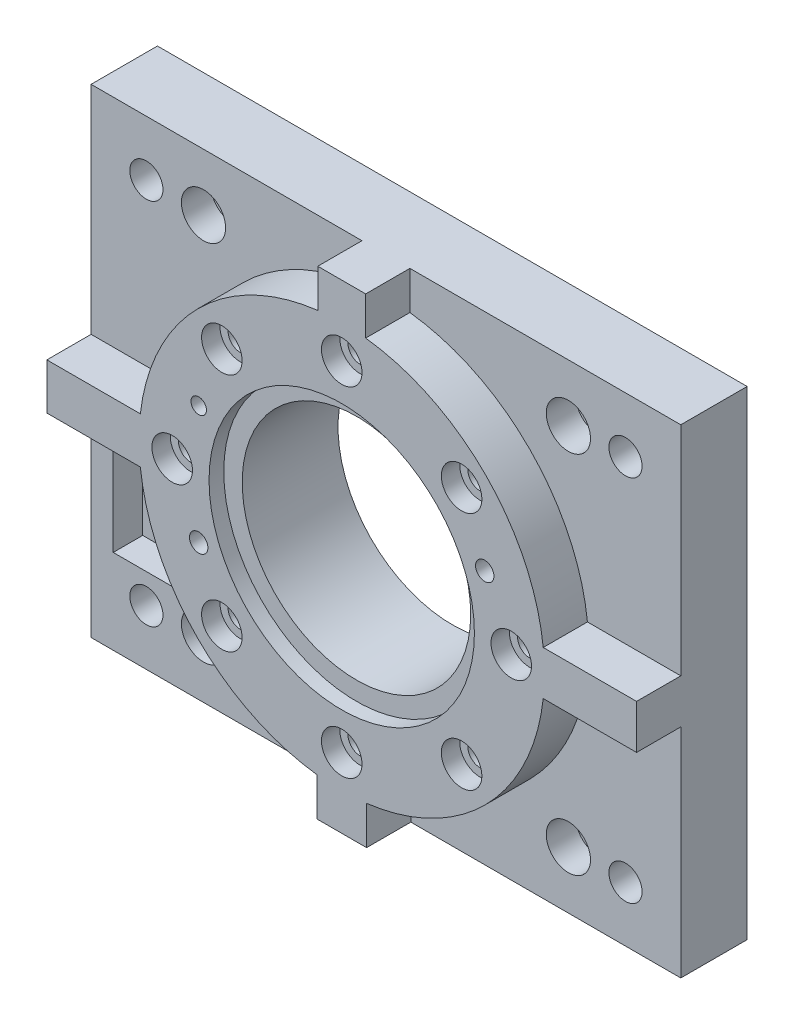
SolidWorks part; units mm, degrees
ref_plane "前视基准面" through (0, 0, 0) normal (0, 0, 1) x (1, 0, 0)
ref_plane "上视基准面" through (0, 0, 0) normal (0, 1, 0) x (1, 0, 0)
ref_plane "右视基准面" through (0, 0, 0) normal (1, 0, 0) x (0, 0, -1)
other "Configuration Table"
sketch "AICAD_SKETCH_F_BASE" plane through (0, 0, 0) normal (0, 0, 1) x (1, 0, 0)
  line L0 (-80, -65) -> (80, -65)
  line L1 (80, -65) -> (80, 65)
  line L2 (80, 65) -> (-80, 65)
  line L3 (-80, 65) -> (-80, -65)
  point P0 (0, 0)
  dimension "D1" = 80
  dimension "D2" = 160
  dimension "D3" = 65
  dimension "D4" = 130
extrude "AICAD_F_BASE_BASE_EXTRUDE" add sketch "AICAD_SKETCH_F_BASE" along normal blind 18
sketch "AICAD_SKETCH_F_FLANGE_BOSS" plane through (0, 0, 18) normal (0, 0, 1) x (1, 0, 0)
  circle A0 centre (0, 0) radius 55
  point P0 (0, 0)
  dimension "D1" = 55
extrude "AICAD_F_FLANGE_BOSS_BOSS_EXTRUDE" add sketch "AICAD_SKETCH_F_FLANGE_BOSS" along normal blind 12
sketch "AICAD_SKETCH_F_RIB_EAST" plane through (0, 0, 18) normal (0, 0, 1) x (1, 0, 0)
  line L0 (50, -6) -> (80, -6)
  line L1 (80, -6) -> (80, 6)
  line L2 (80, 6) -> (50, 6)
  line L3 (50, 6) -> (50, -6)
  line L4 (-80, 65) -> (-80, -65) construction
  line L5 (-80, -65) -> (80, -65) construction
  point P0 (0, 0)
  dimension "D1" = 130
  dimension "D2" = 160
  dimension "D3" = 59
  dimension "D4" = 71
extrude "AICAD_F_RIB_EAST_BOSS_EXTRUDE" add sketch "AICAD_SKETCH_F_RIB_EAST" along normal blind 12
sketch "AICAD_SKETCH_F_RIB_WEST" plane through (0, 0, 18) normal (0, 0, 1) x (1, 0, 0)
  line L0 (-80, -6.25) -> (-50, -6.25)
  line L1 (-50, -6.25) -> (-50, 6.25)
  line L2 (-50, 6.25) -> (-80, 6.25)
  line L3 (-80, 6.25) -> (-80, -6.25)
  line L4 (80, 6) -> (80, 65) construction
  line L5 (80, 65) -> (-80, 65) construction
  point P0 (0, 0)
  dimension "D1" = 130
  dimension "D2" = 160
  dimension "D3" = 58.75
  dimension "D4" = 71.25
extrude "AICAD_F_RIB_WEST_BOSS_EXTRUDE" add sketch "AICAD_SKETCH_F_RIB_WEST" along normal blind 12
sketch "AICAD_SKETCH_F_RIB_NORTH" plane through (0, 0, 18) normal (0, 0, 1) x (1, 0, 0)
  line L0 (-6.5, 50) -> (6.5, 50)
  line L1 (6.5, 50) -> (6.5, 65)
  line L2 (6.5, 65) -> (-6.5, 65)
  line L3 (-6.5, 65) -> (-6.5, 50)
  line L4 (-54.6437, 6.25) -> (-80, 6.25) construction
  point P0 (0, 0)
  dimension "D1" = 73.5
  dimension "D2" = 86.5
  dimension "D3" = 43.75
  dimension "D4" = 58.75
extrude "AICAD_F_RIB_NORTH_BOSS_EXTRUDE" add sketch "AICAD_SKETCH_F_RIB_NORTH" along normal blind 12
sketch "AICAD_SKETCH_F_RIB_SOUTH" plane through (0, 0, 18) normal (0, 0, 1) x (1, 0, 0)
  line L0 (-6.75, -65) -> (6.75, -65)
  line L1 (6.75, -65) -> (6.75, -50)
  line L2 (6.75, -50) -> (-6.75, -50)
  line L3 (-6.75, -50) -> (-6.75, -65)
  line L4 (-6.5, 65) -> (-6.5, 54.6146) construction
  line L5 (-6.5, 65) -> (-80, 65) construction
  point P0 (0, 0)
  dimension "D1" = 13.25
  dimension "D2" = 0.25
  dimension "D3" = 115
  dimension "D4" = 130
extrude "AICAD_F_RIB_SOUTH_BOSS_EXTRUDE" add sketch "AICAD_SKETCH_F_RIB_SOUTH" along normal blind 12
sketch "AICAD_SKETCH_F_BEARING_BORE" plane through (0, 0, 30) normal (0, 0, 1) x (1, 0, 0)
  circle A0 centre (0, 0) radius 31
  point P0 (0, 0)
  dimension "D1" = 31
extrude "AICAD_F_BEARING_BORE_CUT_EXTRUDE" cut sketch "AICAD_SKETCH_F_BEARING_BORE" against normal through all
sketch "AICAD_SKETCH_F_REGISTER_RECESS" plane through (0, 0, 30) normal (0, 0, 1) x (1, 0, 0)
  circle A0 centre (0, 0) radius 36
  point P0 (0, 0)
  dimension "D1" = 36
extrude "AICAD_F_REGISTER_RECESS_CUT_EXTRUDE" cut sketch "AICAD_SKETCH_F_REGISTER_RECESS" against normal blind 4
sketch "AICAD_SKETCH_F_BCD_THROUGH" plane through (0, 0, 30) normal (0, 0, 1) x (1, 0, 0)
  circle A0 centre (46, 0) radius 3.3
  circle A1 centre (32.5269, 32.5269) radius 3.3
  circle A2 centre (0, 46) radius 3.3
  circle A3 centre (-32.5269, 32.5269) radius 3.3
  circle A4 centre (-46, 0) radius 3.3
  circle A5 centre (-32.5269, -32.5269) radius 3.3
  circle A6 centre (0, -46) radius 3.3
  circle A7 centre (32.5269, -32.5269) radius 3.3
  point P0 (0, 0)
  dimension "D2" = 3.3
  dimension "D5" = 3.3
  dimension "D7" = 3.3
  dimension "D10" = 3.3
  dimension "D12" = 3.3
  dimension "D15" = 3.3
  dimension "D17" = 3.3
  dimension "D20" = 3.3
  dimension "D1" = 46
  dimension "D3" = 32.5269
  dimension "D4" = 32.5269
  dimension "D6" = 46
  dimension "D8" = 32.5269
  dimension "D9" = 32.5269
  dimension "D11" = 46
  dimension "D13" = 32.5269
  dimension "D14" = 32.5269
  dimension "D16" = 46
  dimension "D18" = 32.5269
  dimension "D19" = 32.5269
extrude "AICAD_F_BCD_THROUGH_CUT_EXTRUDE" cut sketch "AICAD_SKETCH_F_BCD_THROUGH" against normal through all
sketch "AICAD_SKETCH_F_BCD_COUNTERBORE" plane through (0, 0, 30) normal (0, 0, 1) x (1, 0, 0)
  circle A0 centre (46, 0) radius 5.5
  circle A1 centre (32.5269, 32.5269) radius 5.5
  circle A2 centre (0, 46) radius 5.5
  circle A3 centre (-32.5269, 32.5269) radius 5.5
  circle A4 centre (-46, 0) radius 5.5
  circle A5 centre (-32.5269, -32.5269) radius 5.5
  circle A6 centre (0, -46) radius 5.5
  circle A7 centre (32.5269, -32.5269) radius 5.5
  point P0 (0, 0)
  dimension "D2" = 5.5
  dimension "D5" = 5.5
  dimension "D7" = 5.5
  dimension "D10" = 5.5
  dimension "D12" = 5.5
  dimension "D15" = 5.5
  dimension "D17" = 5.5
  dimension "D20" = 5.5
  dimension "D1" = 46
  dimension "D3" = 32.5269
  dimension "D4" = 32.5269
  dimension "D6" = 46
  dimension "D8" = 32.5269
  dimension "D9" = 32.5269
  dimension "D11" = 46
  dimension "D13" = 32.5269
  dimension "D14" = 32.5269
  dimension "D16" = 46
  dimension "D18" = 32.5269
  dimension "D19" = 32.5269
extrude "AICAD_F_BCD_COUNTERBORE_CUT_EXTRUDE" cut sketch "AICAD_SKETCH_F_BCD_COUNTERBORE" against normal blind 5
sketch "AICAD_SKETCH_F_ANCHOR_TOP" plane through (0, 0, 18) normal (0, 0, 1) x (1, 0, 0)
  circle A0 centre (65, 50) radius 4.5
  circle A1 centre (-65, 50) radius 4.5
  point P0 (0, 0)
  dimension "D3" = 4.5
  dimension "D6" = 4.5
  dimension "D1" = 65
  dimension "D2" = 50
  dimension "D4" = 65
  dimension "D5" = 50
extrude "AICAD_F_ANCHOR_TOP_CUT_EXTRUDE" cut sketch "AICAD_SKETCH_F_ANCHOR_TOP" against normal through all
sketch "AICAD_SKETCH_F_ANCHOR_BOTTOM" plane through (0, 0, 18) normal (0, 0, 1) x (1, 0, 0)
  circle A0 centre (65, -50) radius 4.5
  circle A1 centre (-65, -50) radius 4.5
  point P0 (0, 0)
  dimension "D3" = 4.5
  dimension "D6" = 4.5
  dimension "D1" = 65
  dimension "D2" = 50
  dimension "D4" = 65
  dimension "D5" = 50
extrude "AICAD_F_ANCHOR_BOTTOM_CUT_EXTRUDE" cut sketch "AICAD_SKETCH_F_ANCHOR_BOTTOM" against normal through all
sketch "AICAD_SKETCH_F_POCKET_SW" plane through (0, 0, 18) normal (0, 0, 1) x (1, 0, 0)
  line L0 (-74, -42) -> (-58, -42)
  line L1 (-58, -42) -> (-58, -14)
  line L2 (-58, -14) -> (-74, -14)
  line L3 (-74, -14) -> (-74, -42)
  line L4 (-6.75, -54.5842) -> (-6.75, -65) construction
  point P0 (0, 0)
  dimension "D1" = 51.25
  dimension "D2" = 67.25
  dimension "D3" = 23
  dimension "D4" = 51
extrude "AICAD_F_POCKET_SW_CUT_EXTRUDE" cut sketch "AICAD_SKETCH_F_POCKET_SW" against normal blind 8
sketch "AICAD_SKETCH_F_RELIEF_PATTERN" plane through (0, 0, 18) normal (0, 0, 1) x (1, 0, 0)
  circle A0 centre (49.4975, 49.4975) radius 6
  circle A1 centre (-49.4975, 49.4975) radius 6
  circle A2 centre (-49.4975, -49.4975) radius 6
  circle A3 centre (49.4975, -49.4975) radius 6
  point P0 (0, 0)
  dimension "D3" = 6
  dimension "D6" = 6
  dimension "D9" = 6
  dimension "D12" = 6
  dimension "D1" = 49.4975
  dimension "D2" = 49.4975
  dimension "D4" = 49.4975
  dimension "D5" = 49.4975
  dimension "D7" = 49.4975
  dimension "D8" = 49.4975
  dimension "D10" = 49.4975
  dimension "D11" = 49.4975
extrude "AICAD_F_RELIEF_PATTERN_CUT_EXTRUDE" cut sketch "AICAD_SKETCH_F_RELIEF_PATTERN" against normal blind 8
sketch "AICAD_SKETCH_F_DOWEL_PAIR" plane through (0, 0, 30) normal (0, 0, 1) x (1, 0, 0)
  circle A0 centre (38.8029, 16.0727) radius 2.5
  circle A1 centre (-38.8029, -16.0727) radius 2.5
  point P0 (0, 0)
  dimension "D3" = 2.5
  dimension "D6" = 2.5
  dimension "D1" = 38.8029
  dimension "D2" = 16.0727
  dimension "D4" = 38.8029
  dimension "D5" = 16.0727
extrude "AICAD_F_DOWEL_PAIR_CUT_EXTRUDE" cut sketch "AICAD_SKETCH_F_DOWEL_PAIR" against normal through all
sketch "AICAD_SKETCH_F_LUBE_PORT" plane through (0, 0, 30) normal (0, 0, 1) x (1, 0, 0)
  circle A0 centre (-38.8029, 16.0727) radius 2.1
  point P0 (0, 0)
  dimension "D3" = 2.1
  dimension "D1" = 38.8029
  dimension "D2" = 16.0727
extrude "AICAD_F_LUBE_PORT_CUT_EXTRUDE" cut sketch "AICAD_SKETCH_F_LUBE_PORT" against normal blind 6
